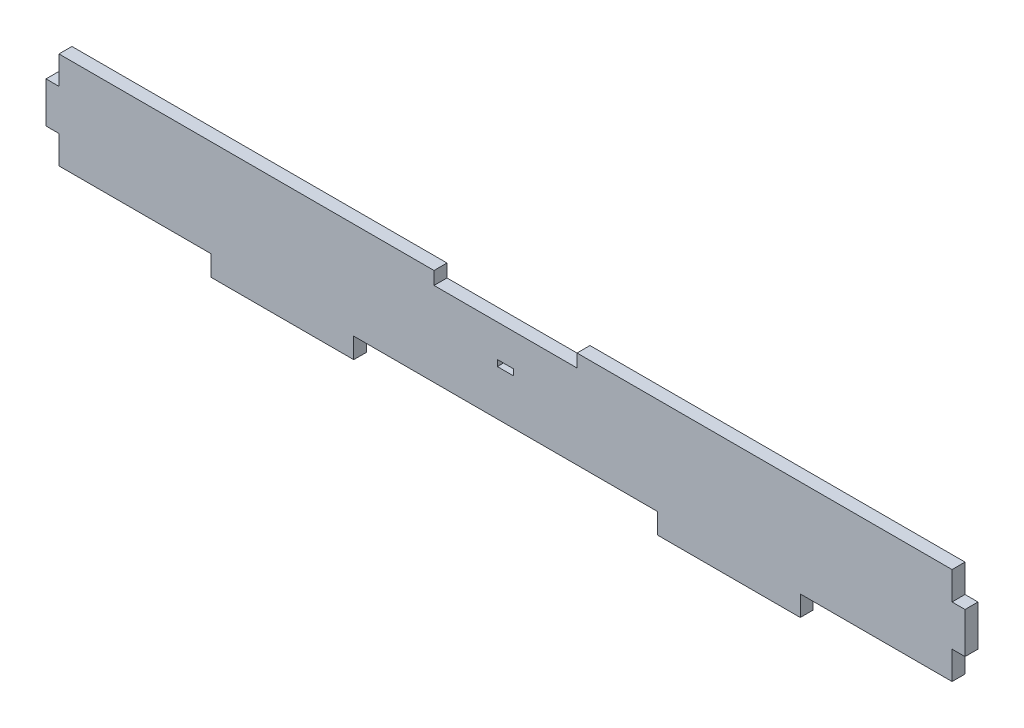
SolidWorks part; units mm, degrees
ref_plane "Front Plane" through (0, 0, 0) normal (0, 0, 1) x (1, 0, 0)
ref_plane "Top Plane" through (0, 0, 0) normal (0, 1, 0) x (1, 0, 0)
ref_plane "Right Plane" through (0, 0, 0) normal (1, 0, 0) x (0, 0, -1)
sketch "Sketch1" plane through (0, 0, 0) normal (0, 0, 1) x (1, 0, 0)
  line L0 (-35, 23.75) -> (-218.65, 23.75)
  line L1 (218.65, -23.75) -> (144.325, -23.75)
  line L2 (225, -10) -> (225, 10)
  line L3 (218.65, 23.75) -> (35, 23.75)
  line L4 (-225, -10) -> (-225, 10)
  line L6 (-35, 23.75) -> (-35, 17.4)
  line L7 (4, -1.5) -> (-4, -1.5)
  line L8 (4, -1.5) -> (4, 1.5)
  line L9 (4, 1.5) -> (-4, 1.5)
  line L10 (-4, -1.5) -> (-4, 1.5)
  line L11 (-35, 17.4) -> (35, 17.4)
  line L12 (35, 23.75) -> (35, 17.4)
  line L15 (-225, 10) -> (-218.65, 10)
  line L16 (-218.65, 23.75) -> (-218.65, 10)
  line L19 (-225, -10) -> (-218.65, -10)
  line L20 (-218.65, -23.75) -> (-218.65, -10)
  line L23 (225, 10) -> (218.65, 10)
  line L24 (218.65, 23.75) -> (218.65, 10)
  line L27 (225, -10) -> (218.65, -10)
  line L28 (218.65, -23.75) -> (218.65, -10)
  line L30 (-144.325, -23.75) -> (-144.325, -33.75)
  line L31 (-144.325, -33.75) -> (-74.325, -33.75)
  line L32 (-74.325, -23.75) -> (-74.325, -33.75)
  line L34 (74.325, -23.75) -> (74.325, -33.75)
  line L35 (74.325, -33.75) -> (144.325, -33.75)
  line L36 (144.325, -23.75) -> (144.325, -33.75)
  line L37 (74.325, -23.75) -> (-74.325, -23.75)
  line L38 (-144.325, -23.75) -> (-218.65, -23.75)
  point P0 (0, 0)
  point P6 (0, 0)
  point P31 (221.825, 10)
  point P32 (221.825, -10)
  point P33 (0, 17.4)
  dimension "D2" = 47.5
  dimension "D3" = 8
  dimension "D4" = 3
  dimension "D5" = 20
  dimension "D6" = 13.75
  dimension "D7" = 6.35
  dimension "D8" = 6.35
  dimension "D9" = 6.35
  dimension "D10" = 6.35
  dimension "D11" = 20
  dimension "D12" = 13.75
  dimension "D13" = 22.25
  dimension "D14" = 4
  dimension "D15" = 437.3
  dimension "D16" = 23.75
  dimension "D17" = 225
  dimension "D18" = 70
  dimension "D19" = 70
  dimension "D20" = 10
  dimension "D21" = 10
  dimension "D22" = 6.35
  dimension "D23" = 70
  dimension "D24" = 74.325
  dimension "D25" = 74.325
  dimension "D26" = 218.65
extrude "Boss-Extrude1" add sketch "Sketch1" along normal blind 6.35
